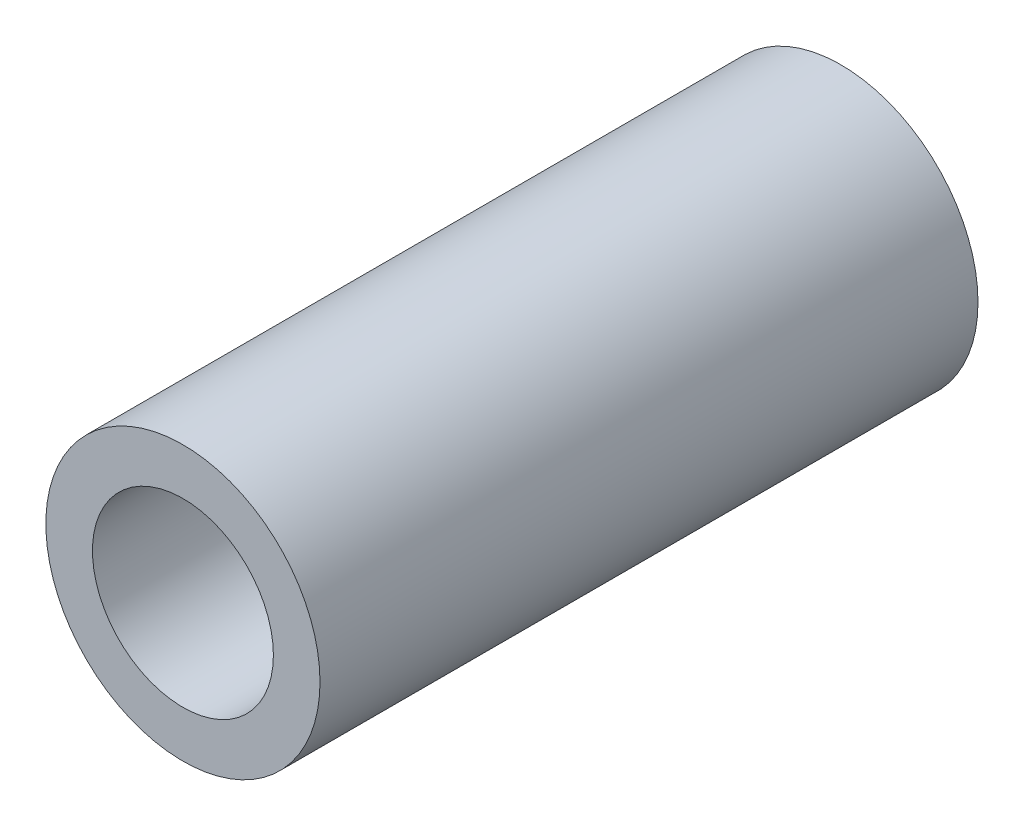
SolidWorks part; units mm, degrees
ref_plane "Plan de face" through (0, 0, 0) normal (0, 0, 1) x (1, 0, 0)
ref_plane "Plan de dessus" through (0, 0, 0) normal (0, 1, 0) x (1, 0, 0)
ref_plane "Plan de droite" through (0, 0, 0) normal (1, 0, 0) x (0, 0, -1)
sketch "Esquisse1" plane through (0, 0, 0) normal (0, 0, 1) x (1, 0, 0)
  circle A0 centre (0, 0) radius 2.5
extrude "Boss.-Extru.1" add sketch "Esquisse1" along normal blind 12
hole_wizard "Trou taraudé M41" positions "Esquisse4" profile "Esquisse3" tap size "M4" standard "Iso"
sketch "Esquisse4" plane through (0, 0, 12) normal (0, 0, 1) x (1, 0, 0)
  point P0 (0, 0)
sketch "Esquisse3" plane through (0, 0, 12) normal (1, 0, 0) x (0, -1, 0)
  line L0 (0, 0) -> (0, 12)
  line L1 (0, 12) -> (1.65, 12)
  line L2 (1.65, 12) -> (1.65, 0)
  line L5 (1.65, 0) -> (0, 0)
  line L11 (0, -6.35) -> (0, 107.95) construction
  dimension "Diamètre du trou pour taraudage jusqu'au prochain" = 3.3
  dimension "Profondeur du trou pour taraudage jusqu'au prochain" = 12
